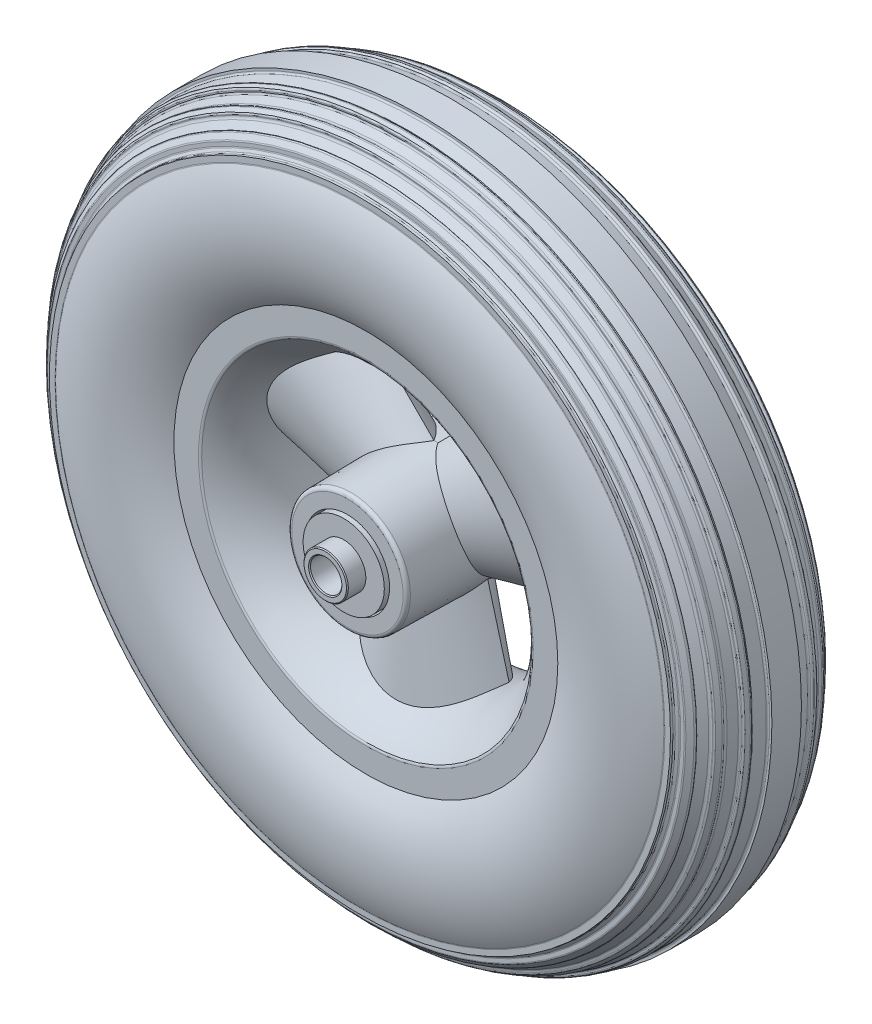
SolidWorks part; units mm, degrees
ref_plane "Plan de face" through (0, 0, 0) normal (0, 0, 1) x (1, 0, 0)
ref_plane "Plan de dessus" through (0, 0, 0) normal (0, 1, 0) x (1, 0, 0)
ref_plane "Plan de droite" through (0, 0, 0) normal (1, 0, 0) x (0, 0, -1)
sketch "Esquisse1" plane through (0, 0, 0) normal (0, 0, 1) x (1, 0, 0)
  circle A0 centre (0, 0) radius 6
  circle A1 centre (0, 0) radius 4.25
  dimension "D1" = 12
  dimension "D2" = 8.5
extrude "Boss.-Extru.1" add sketch "Esquisse1" along normal mid plane 60
chamfer "Chanfrein1" distance 0.25 angle 45 4 edges at (4.25, 0, -30) (6, 0, -30) (4.25, 0, 30) (6, 0, 30)
sketch "Esquisse2" plane through (0, 0, 0) normal (0, 0, 1) x (1, 0, 0)
  circle A0 centre (0, 0) radius 11
  circle A1 centre (0, 0) radius 6 construction
  circle A2 centre (0, 0) radius 6
  dimension "D1" = 22
extrude "Boss.-Extru.2" add sketch "Esquisse2" along normal mid plane 50
sketch "Esquisse3" plane through (0, 0, 0) normal (0, 0, 1) x (1, 0, 0)
  circle A0 centre (0, 0) radius 16.5
  circle A1 centre (0, 0) radius 11 construction
  circle A2 centre (0, 0) radius 11
  dimension "D1" = 33
extrude "Boss.-Extru.3" add sketch "Esquisse3" along normal mid plane 48 draft 1
fillet "Congé1" radius 1 3 edges at (16.0811, 0, -24) (16.0811, 0, 24) (16.5, 0, 0)
sketch "Esquisse4" plane through (0, 0, 0) normal (1, 0, 0) x (0, 0, -1)
  line L0 (-56.5794, 0) -> (52.3821, 0) construction
  line L1 (-19, 52) -> (-19, 45.3613)
  line L3 (19, 45.3613) -> (19, 52)
  line L4 (19, 52) -> (-19, 52)
  line L5 (0, 0) -> (0, 62.7074) construction
  arc A0 (-18.7642, 44.7163) -> (18.7642, 44.7163) centre (0, 60.5556) ccw
  arc A1 (-19, 45.3613) -> (-18.7642, 44.7163) centre (-18, 45.3613) ccw
  arc A2 (18.7642, 44.7163) -> (19, 45.3613) centre (18, 45.3613) ccw
  point P12 (-19, 45)
  point P15 (19, 45)
  dimension "D4" = 72
  dimension "D5" = 1
  dimension "D1" = 38
  dimension "D2" = 104
  dimension "D3" = 90
ref_plane "Plan1" through (0, -5, 0) normal (0, 1, 0) x (1, 0, 0)
sketch "Esquisse5" plane through (0, -5, 0) normal (0, 1, 0) x (1, 0, 0)
  line L0 (0, 11.2029) -> (0, -11.0957) construction
  line L1 (15.0984, 24) -> (-15.0984, 24) construction
  line L2 (-24.6572, 0) -> (23.7995, 0) construction
  arc A0 (-13, 0) -> (13, 0) centre (0, -5.6912) cw
  arc A1 (-13, 0) -> (13, 0) centre (0, 5.6912) ccw
  point P13 (13, 0)
  point P16 (-13, 0)
  dimension "D1" = 15.5
  dimension "D2" = 26
ref_plane "Plan3" through (0, -40, 0) normal (0, 1, 0) x (1, 0, 0)
sketch "Esquisse6" plane through (0, -40, 0) normal (0, 1, 0) x (1, 0, 0)
  line L0 (-24.6572, 0) -> (23.7995, 0) construction
  line L1 (0, 11.2029) -> (0, -11.0957) construction
  line L3 (15.0984, 24) -> (-15.0984, 24) construction
  arc A0 (-22.5, 0) -> (22.5, 0) centre (0, -17.5114) cw
  arc A1 (-22.5, 0) -> (22.5, 0) centre (0, 17.5114) ccw
  point P14 (22.5, 0)
  point P19 (-22.5, 0)
  dimension "D3" = 13
  dimension "D1" = 45
loft "Lissage10" add profiles "Esquisse5", "Esquisse6"
revolve "Révolution2" add sketch "Esquisse4" angle 360 about L0
pattern_circular "Répétition circulaire1" count 3 over 360 of "Lissage10"
sketch "Esquisse7" plane through (0, 0, 0) normal (1, 0, 0) x (0, 0, -1)
  line L0 (0, 52) -> (0, 130.1738) construction
  line L1 (19, 52) -> (-19, 52) construction
  line L2 (-46.4295, 0) -> (51.1116, 0) construction
  line L3 (4, 95) -> (-4, 95)
  line L4 (-4, 94) -> (-4, 95)
  line L5 (-4, 94) -> (-8, 93.0927)
  line L6 (-8, 93.0927) -> (-8, 94.0927)
  line L7 (-8, 94.0927) -> (-10, 93.3426)
  line L8 (-10, 93.3426) -> (-10, 92.3426)
  line L9 (-10, 92.3426) -> (-13, 91.0208)
  line L10 (-13, 91.0208) -> (-13, 91.7854)
  line L11 (-13, 91.7854) -> (-15, 90.4018)
  line L12 (-15, 90.4018) -> (-15, 89.5063)
  line L13 (-15, 89.5063) -> (-17, 87.599)
  line L14 (-17, 87.599) -> (-17, 88.6625)
  line L15 (-17, 88.6625) -> (-19, 86.438)
  line L16 (-19, 86.438) -> (-19, 85.1317)
  line L17 (-20.6004, 82.5) -> (-20.6004, 84.1292)
  line L18 (-20.6004, 84.1292) -> (-19.6666, 84.1292)
  line L19 (-19.6666, 84.1292) -> (-19, 85.1317)
  line L20 (-19, 52) -> (19, 52)
  line L21 (4, 94) -> (4, 95)
  line L22 (4, 94) -> (8, 93.0927)
  line L23 (8, 93.0927) -> (8, 94.0927)
  line L24 (8, 94.0927) -> (10, 93.3426)
  line L25 (10, 93.3426) -> (10, 92.3426)
  line L26 (10, 92.3426) -> (13, 91.0208)
  line L27 (13, 91.0208) -> (13, 91.7854)
  line L28 (13, 91.7854) -> (15, 90.4018)
  line L29 (15, 90.4018) -> (15, 89.5063)
  line L30 (15, 89.5063) -> (17, 87.599)
  line L31 (17, 87.599) -> (17, 88.6625)
  line L32 (17, 88.6625) -> (19, 86.438)
  line L33 (19, 86.438) -> (19, 85.1317)
  line L34 (19.6666, 84.1292) -> (19, 85.1317)
  line L35 (20.6004, 84.1292) -> (19.6666, 84.1292)
  line L36 (20.6004, 82.5) -> (20.6004, 84.1292)
  arc A0 (-19, 52) -> (-20.6004, 82.5) centre (6.0829, 68.6081) cw
  arc A1 (-20.6004, 82.5) -> (0, 95) centre (0, 71.775) cw construction
  arc A2 (-4, 95) -> (-21.5, 82.5) centre (-0.9325, 72.2055) ccw construction
  arc A3 (19, 52) -> (20.6004, 82.5) centre (-6.0829, 68.6081) ccw
  dimension "D1" = 48
  dimension "D10" = 23
  dimension "D13" = 1
  dimension "D2" = 190
  dimension "D3" = 165
  dimension "D4" = 8
  dimension "D5" = 43
  dimension "D6" = 4
  dimension "D7" = 20
  dimension "D8" = 30
  dimension "D9" = 38
  dimension "D11" = 2
  dimension "D12" = 2
  dimension "D14" = 1
  dimension "D15" = 1
revolve "Révolution3" add sketch "Esquisse7" angle 360 about L2
fillet "Congé2" radius 0.5 4 edges at (94.0927, 0, -8) (94.0927, 0, 8) (94, 0, -4) (94, 0, 4)
fillet "Congé4" radius 0.5 2 edges at (92.3426, 0, -10) (92.3426, 0, 10)
fillet "Congé5" radius 0.5 4 edges at (90.4018, 0, 15) (90.4018, 0, -15) (91.7854, 0, -13) (91.7854, 0, 13)
fillet "Congé6" radius 1 4 edges at (89.5063, 0, -15) (91.0208, 0, -13) (89.5063, 0, 15) (91.0208, 0, 13)
fillet "Congé8" radius 0.5 2 edges at (88.6625, 0, -17) (88.6625, 0, 17)
fillet "Congé9" radius 0.5 2 edges at (86.438, 0, -19) (86.438, 0, 19)
fillet "Congé10" radius 0.5 2 edges at (85.1317, 0, -19) (85.1317, 0, 19)
fillet "Congé11" radius 0.5 2 edges at (82.5, 0, 20.6004) (82.5, 0, -20.6004)
fillet "Congé12" radius 0.5 2 edges at (84.1292, 0, -19.6666) (84.1292, 0, 19.6666)
fillet "Congé13" radius 0.5 2 edges at (93.0927, 0, -8) (93.0927, 0, 8)
fillet "Congé14" radius 0.5 2 edges at (93.3426, 0, -10) (93.3426, 0, 10)
